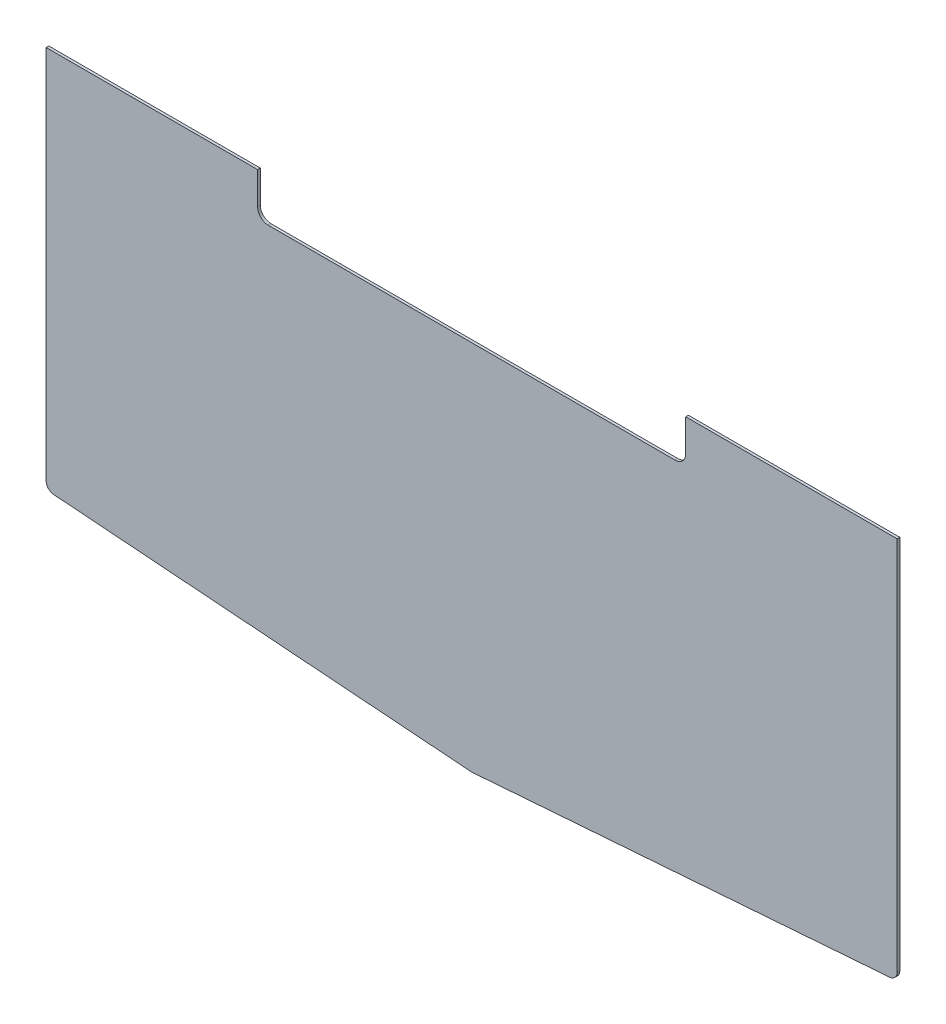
SolidWorks part; units mm, degrees
ref_plane "Front Plane" through (0, 0, 0) normal (0, 0, 1) x (1, 0, 0)
ref_plane "Top Plane" through (0, 0, 0) normal (0, 1, 0) x (1, 0, 0)
ref_plane "Right Plane" through (0, 0, 0) normal (1, 0, 0) x (0, 0, -1)
sketch "Sketch1" plane through (0, 0, 0) normal (0, 0, 1) x (1, 0, 0)
  line L0 (-252.4125, 107.4916) -> (-252.4125, 330.2) construction
  line L1 (-252.4125, 107.4916) -> (-252.4125, 330.2)
  line L2 (-248.0062, 102.7424) -> (-0.3562, 84.1687) construction
  line L3 (-248.0062, 102.7424) -> (-0.3562, 84.1687)
  line L4 (0.3562, 84.1687) -> (248.0062, 102.7424) construction
  line L5 (0.3562, 84.1687) -> (248.0062, 102.7424)
  line L6 (252.4125, 107.4916) -> (252.4125, 330.2) construction
  line L7 (252.4125, 107.4916) -> (252.4125, 330.2)
  line L8 (252.4125, 330.2) -> (-252.4125, 330.2)
  arc A0 (-252.4125, 107.4916) -> (-248.0062, 102.7424) centre (-247.65, 107.4916) ccw construction
  arc A1 (-252.4125, 107.4916) -> (-248.0062, 102.7424) centre (-247.65, 107.4916) ccw
  arc A2 (-0.3562, 84.1687) -> (0.3562, 84.1687) centre (0, 88.9178) ccw construction
  arc A3 (-0.3562, 84.1687) -> (0.3562, 84.1687) centre (0, 88.9178) ccw
  arc A4 (248.0062, 102.7424) -> (252.4125, 107.4916) centre (247.65, 107.4916) ccw construction
  arc A5 (248.0062, 102.7424) -> (252.4125, 107.4916) centre (247.65, 107.4916) ccw
extrude "Extrude1" add sketch "Sketch1" along normal blind 1.5875
sketch "Sketch2" plane through (0, 0, 1.5875) normal (0, 0, 1) x (1, 0, 0)
  line L0 (0, 0) -> (0, 304.8) construction
  line L1 (252.4125, 330.2) -> (-252.4125, 330.2) construction
  line L2 (-127, 330.2) -> (127, 330.2)
  line L3 (-127, 330.2) -> (-127, 304.8)
  line L4 (-127, 304.8) -> (127, 304.8)
  line L5 (127, 330.2) -> (127, 304.8)
  dimension "D1" = 254
  dimension "D2" = 25.4
extrude "Cut-Extrude1" cut sketch "Sketch2" against normal through all
fillet "Fillet1" radius 6.35 2 edges at (127, 304.8, 0.7937) (-127, 304.8, 0.7937)
